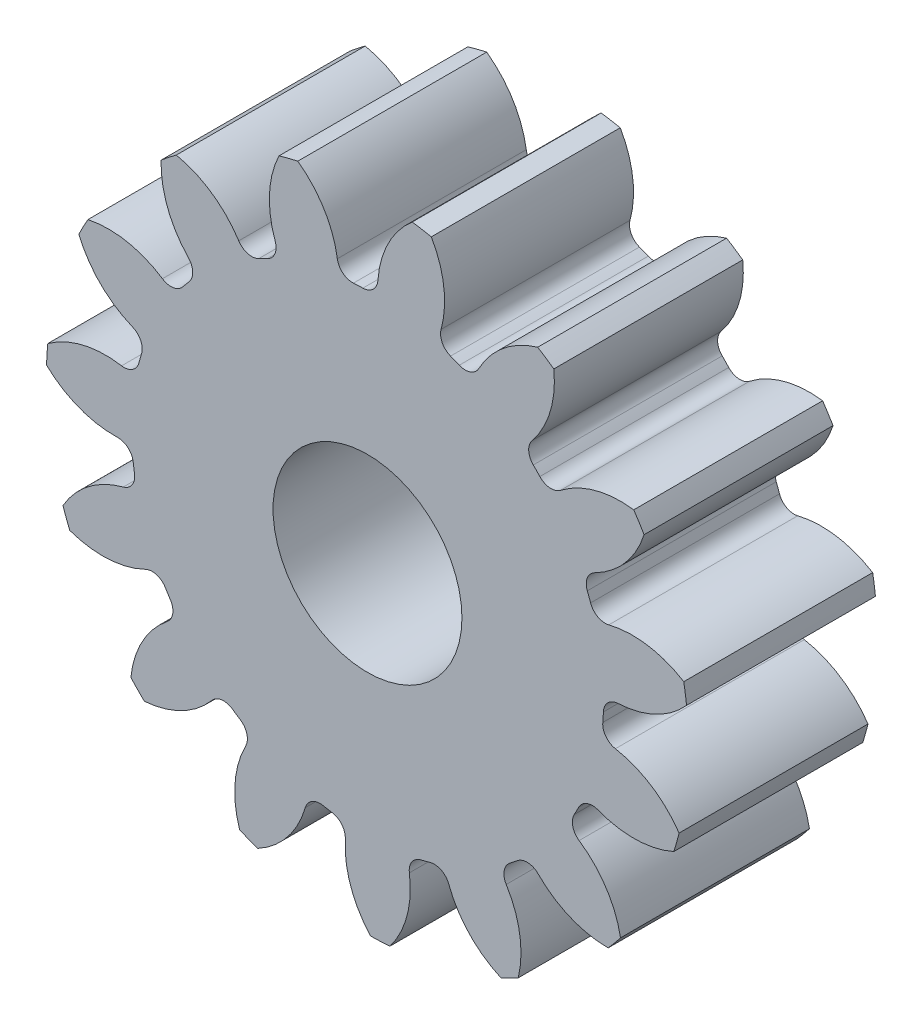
SolidWorks part; units mm, degrees
ref_plane "Front" through (0, 0, 0) normal (0, 0, 1) x (1, 0, 0)
ref_plane "Top" through (0, 0, 0) normal (0, 1, 0) x (1, 0, 0)
ref_plane "Right" through (0, 0, 0) normal (1, 0, 0) x (0, 0, -1)
sketch "Sketch3" plane through (0, 0, 0) normal (0, 0, 1) x (1, 0, 0)
  circle A0 centre (0, 0) radius 172.72
  dimension "od" = 345.44
extrude "gearBody" add sketch "Sketch3" along normal blind 101.6
sketch "Sketch2" plane through (0, 0, 0) normal (0, 0, 1) x (1, 0, 0)
  line L0 (0, 0) -> (132.308, 54.8038) construction
  line L1 (168.5296, -43.234) -> (0, 0) construction
  line L2 (0, 0) -> (36.3143, 0) construction
  line L3 (152.281, 6.0204) -> (150.2059, -25.767) construction
  line L5 (151.2435, -9.8733) -> (0, 0) construction
  line L7 (0, 0) -> (143.2092, 0) construction
  arc A0 (143.1729, 3.2219) -> (141.5389, -21.8081) centre (0, 0) ccw construction
  arc A1 (171.5974, 19.6601) -> (167.5851, -41.8022) centre (0, 0) ccw construction
  arc A2 (152.281, 6.0204) -> (150.2059, -25.767) centre (0, 0) ccw construction
  arc A3 (126.5398, -10.8019) -> (126.8702, -5.7409) centre (0, 0) ccw
  arc A4 (168.5296, -43.234) -> (133.3263, -19.6468) centre (124.0602, -71.5397) ccw
  arc A5 (168.5296, -43.234) -> (172.72, 20.957) centre (0, 0) ccw
  arc A6 (172.72, 20.957) -> (134.749, 2.1466) centre (132.308, 54.8038) cw
  arc A7 (126.8702, -5.7409) -> (134.749, 2.1466) centre (135.132, -6.1148) cw
  arc A8 (133.3263, -19.6468) -> (126.5398, -10.8019) centre (134.7801, -11.5053) cw
  point P6 (172.72, 20.957)
  point P22 (168.5296, -43.234)
  dimension "baseDia" = 286.4183
  dimension "od" = 345.44
  dimension "pd" = 304.8
  dimension "rd" = 254
  dimension "rFillet" = 8.2702
  dimension "pointX" = 172.72
  dimension "pointY" = 20.957
  dimension "CTT" = 31.7875
  dimension "flankCenterAngle" = 22.5
extrude "toothCut" cut sketch "Sketch2" along normal through all
pattern_circular "CirPattern1" count 15 over 360 about axis through (0, 0, 0) along (0, 0, 1) of "toothCut"
sketch "hub1Dia" plane through (0, 0, 0) normal (0, 0, -1) x (-1, 0, 0)
  circle A0 centre (0, 0) radius 12.7
  dimension "hub1Dia" = 25.4
sketch "hub2Dia" plane through (0, 0, 101.6) normal (0, 0, 1) x (1, 0, 0)
  circle A0 centre (0, 0) radius 12.7
  dimension "hub2dia" = 25.4
sketch "boreDia" plane through (0, 0, 0) normal (0, 0, 1) x (1, 0, 0)
  circle A0 centre (0, 0) radius 50.8
  dimension "boreDia" = 101.6
extrude "bore" cut sketch "boreDia" against normal mid plane 25400
